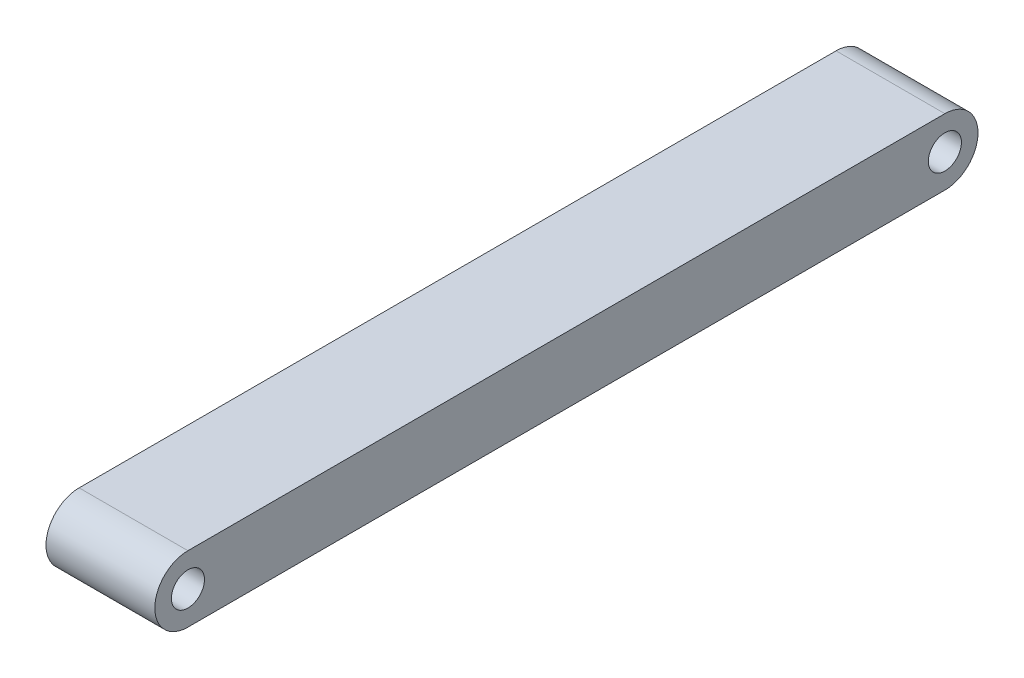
SolidWorks part; units mm, degrees
ref_plane "Front" through (0, 0, 0) normal (0, 0, 1) x (1, 0, 0)
ref_plane "Top" through (0, 0, 0) normal (0, 1, 0) x (1, 0, 0)
ref_plane "Right" through (0, 0, 0) normal (1, 0, 0) x (0, 0, -1)
sketch "Sketch1" plane through (0, 0, 0) normal (1, 0, 0) x (0, 0, -1)
  line L0 (0, 0) -> (800, 0) construction
  line L1 (0, 35) -> (800, 35)
  line L2 (0, -35) -> (800, -35)
  arc A0 (0, 35) -> (0, -35) centre (0, 0) ccw
  arc A1 (800, -35) -> (800, 35) centre (800, 0) ccw
  circle A2 centre (0, 0) radius 17.5
  circle A3 centre (800, 0) radius 17.5
  point P3 (400, 0)
  dimension "D1" = 800
  dimension "D2" = 35
  dimension "D3" = 70
extrude "Boss-Extrude1" add sketch "Sketch1" along normal blind 115
